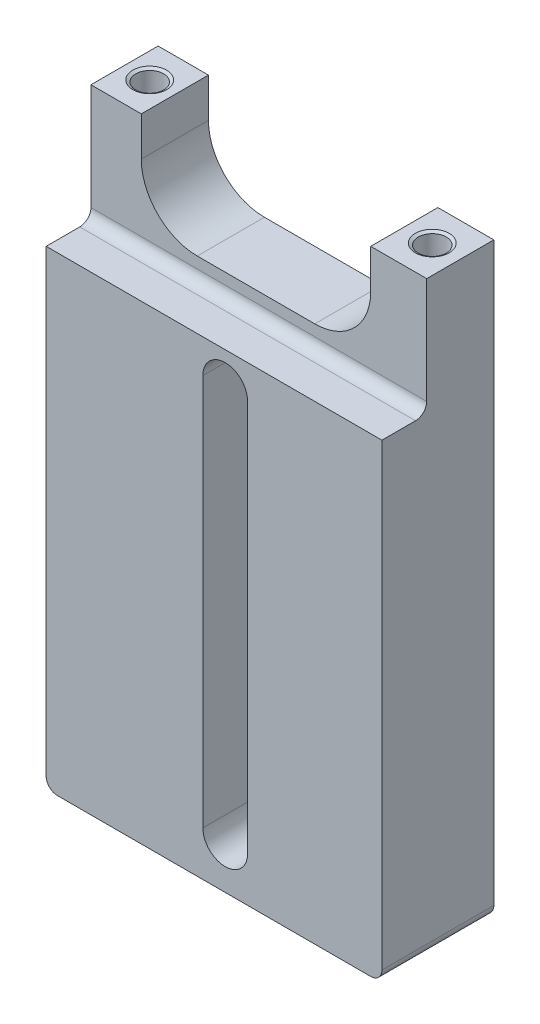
SolidWorks part; units mm, degrees
ref_plane "Face" through (0, 0, 0) normal (0, 0, 1) x (1, 0, 0)
ref_plane "Dessus" through (0, 0, 0) normal (0, 1, 0) x (1, 0, 0)
ref_plane "Droite" through (0, 0, 0) normal (1, 0, 0) x (0, 0, -1)
sketch "Esquisse1" plane through (0, 0, 0) normal (0, 0, 1) x (1, 0, 0)
  line L0 (-25.5, 105) -> (25, 109.4182) construction
  line L1 (30, 105) -> (30, 0)
  line L2 (30, 0) -> (-30, 0)
  line L3 (-30, 0) -> (-30, 105)
  line L4 (-21, 105) -> (-21, 98)
  line L5 (-11, 88) -> (10, 88)
  line L6 (20, 98) -> (20, 105)
  line L7 (-30, 105) -> (-21, 105)
  line L8 (30, 109.4182) -> (30, 105) construction
  line L9 (20, 108.9807) -> (20, 109.4182) construction
  line L10 (20, 108.9807) -> (20, 105) construction
  line L11 (20, 105) -> (30, 105)
  arc A0 (-21, 98) -> (-11, 88) centre (-11, 98) ccw
  arc A1 (10, 88) -> (20, 98) centre (10, 98) ccw
  arc A3 (-30, 105) -> (-21, 105) centre (-25.5, 105) cw construction
  arc A4 (20, 109.4182) -> (30, 109.4182) centre (25, 109.4182) cw construction
  dimension "D5" = 10
  dimension "D6" = 105
  dimension "D4" = 88
  dimension "D7" = 4.5
  dimension "D10" = 5
  dimension "D2" = 60
  dimension "D3" = 5
extrude "Boss.-Extru.1" add sketch "Esquisse1" along normal blind 20
sketch "Esquisse3" plane through (0, 0, 20) normal (0, 0, 1) x (1, 0, 0)
  line L0 (-30, 139.6705) -> (-30, 84)
  line L1 (-30, 139.6705) -> (30, 139.6705)
  line L2 (-30, 84) -> (30, 84)
  line L3 (30, 139.6705) -> (30, 84)
  line L4 (30, 0) -> (30, 105) construction
  line L5 (-30, 105) -> (-30, 0) construction
  line L6 (-30, 0) -> (30, 0) construction
  line L7 (-30, 105) -> (-30, 0) construction
  line L8 (30, 0) -> (30, 105) construction
  dimension "D1" = 84
extrude "Enlèv. mat.-Extru.1" cut sketch "Esquisse3" against normal blind 8
sketch "Esquisse4" plane through (0, 0, 0) normal (0, 0, -1) x (-1, 0, 0)
  line L1 (30, 0) -> (-30, 0) construction
  line L2 (-6, 78) -> (-6, 8)
  line L4 (2, 78) -> (2, 8)
  arc A0 (-6, 8) -> (2, 8) centre (-2, 8) ccw
  arc A1 (-6, 78) -> (2, 78) centre (-2, 78) cw
  dimension "D1" = 8
  dimension "D2" = 70
  dimension "D3" = 8
  dimension "D4" = 28
extrude "Enlèv. mat.-Extru.2" cut sketch "Esquisse4" against normal up to next
fillet "Congé2" radius 2 3 edges at (0, 84, 12) (-30, 0, 10) (30, 0, 10)
hole_wizard "Trou taraudé M61" positions "Esquisse6" profile "Esquisse5" tap size "M6" standard "ISO"
sketch "Esquisse6" plane through (0, 105, 0) normal (0, 1, 0) x (-1, 0, 0)
  line L1 (30, 6) -> (-30, 6) construction
  line L2 (30, 12) -> (30, 0) construction
  line L3 (-30, 12) -> (-30, 0) construction
  line L6 (-25, 0) -> (-25, 12) construction
  line L7 (-30, 0) -> (-20, 0) construction
  line L8 (-20, 12) -> (-30, 12) construction
  line L11 (25.5, 0) -> (25.5, 12) construction
  line L12 (21, 0) -> (30, 0) construction
  line L13 (30, 12) -> (21, 12) construction
  point P0 (25.5, 6)
  point P1 (-25, 6)
sketch "Esquisse5" plane through (-25.5, 105, 6) normal (1, 0, 0) x (0, 0, 1)
  line L0 (0, 0) -> (0, 28.5022)
  line L1 (0, 28.5022) -> (2.5, 27)
  line L2 (2.5, 27) -> (2.5, 0.3031)
  line L3 (2.5, 0.3031) -> (3.025, 0)
  line L5 (3.025, 0) -> (0, 0)
  line L6 (-2.5, 0.3031) -> (-3.025, 0) construction
  line L10 (0, 28.5022) -> (-2.5, 27) construction
  line L11 (0, -6.35) -> (0, 107.95) construction
  dimension "Diamètre du trou pour taraudage" = 5
  dimension "Profondeur du trou pour taraudage" = 27
  dimension "Diamètre du fraisage entrant" = 6.05
  dimension "Angle du fraisage entrant" = 120
  dimension "Angle de pointe" = 118
